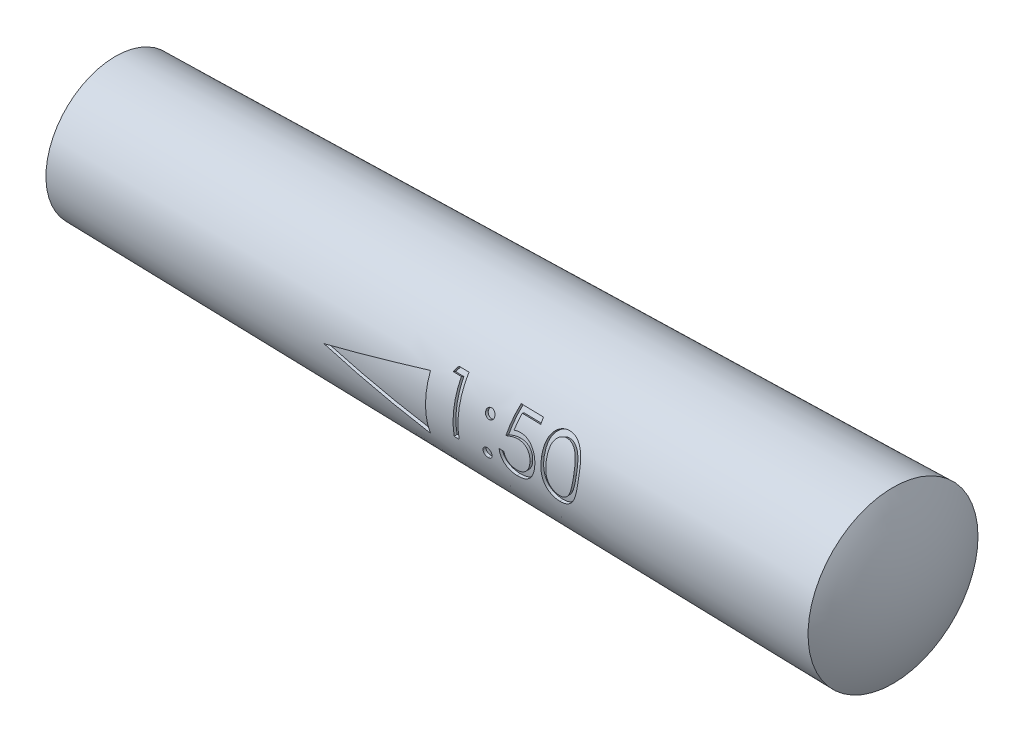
SolidWorks part; units mm, degrees
ref_plane "Front Plane" through (0, 0, 0) normal (0, 0, 1) x (1, 0, 0)
ref_plane "Top Plane" through (0, 0, 0) normal (0, 1, 0) x (1, 0, 0)
ref_plane "Right Plane" through (0, 0, 0) normal (1, 0, 0) x (0, 0, -1)
sketch "Sketch1" plane through (0, 0, 0) normal (1, 0, 0) x (0, 0, -1)
  circle A0 centre (0, 0) radius 1.25
  dimension "D1" = 2.5
extrude "Extrude1" add sketch "Sketch1" along normal mid plane 14
draft "Draft1" type of draft neutral plane draft angle 1.146 faces to draft 1 parameters "D1"=1.146
sketch "Sketch2" plane through (0, 0, 0) normal (0, 0, 1) x (1, 0, 0)
  line L0 (-7, 0) -> (-7, 1.25)
  line L1 (-7, 1.25) -> (-7, -1.25) construction
  line L2 (-7, 0) -> (-7.4, 0)
  line L3 (-7.4, 0) -> (-7.4, -1.39) construction
  line L4 (7, 0) -> (7, 1.53)
  line L5 (7, -1.53) -> (7, 1.53) construction
  line L6 (7, 0) -> (7.4, 0)
  line L7 (7.4, 0) -> (7.4, -1.39) construction
  line L8 (-7, -1.25) -> (7, -1.53) construction
  arc A0 (-7.4, 0) -> (-7, 1.25) centre (-5.2469, 0) cw
  arc A1 (7.4, 0) -> (7, 1.53) centre (4.2738, 0) ccw
  point P14 (0, -1.39)
revolve "Revolve1" add sketch "Sketch2" angle 360 about L2
sketch "Sketch5" plane through (0, 0, 0) normal (0, 0, 1) x (1, 0, 0)
  line L0 (0, 1.39) -> (0, -1.39) construction
  line L1 (7, 1.53) -> (-7, 1.25) construction
  line L2 (-7, -1.25) -> (7, -1.53) construction
ref_plane "Plane2" through (0, 0, 0) normal (-0.02, 0, 0.9998) x (0.9998, 0, 0.02)
sketch "Sketch6" plane through (0, 0, 0) normal (-0.02, 0, 0.9998) x (0.9998, 0, 0.02)
  line L0 (0, 0) -> (0, 0.5)
  line L1 (0, 1.39) -> (0, -1.39) construction
  line L2 (0, 0.5) -> (-1.866, 0)
  line L3 (-1.866, 0) -> (0, -0.5)
  line L4 (0, -0.5) -> (0, 0)
  line L5 (0, -0.25) -> (3, -0.25) construction
  text T0 "1:50" font "Century Gothic" height 1
  dimension "D1" = 1
  dimension "D2" = 30
  dimension "D3" = 3
wrap "Wrap2" sketch "Sketch6" wrap type deboss source sketch "Sketch6" thickness 0.05 parameters "D1"=0.05
equation "\"D2@Sketch2\" = \"D1@Sketch2\""
